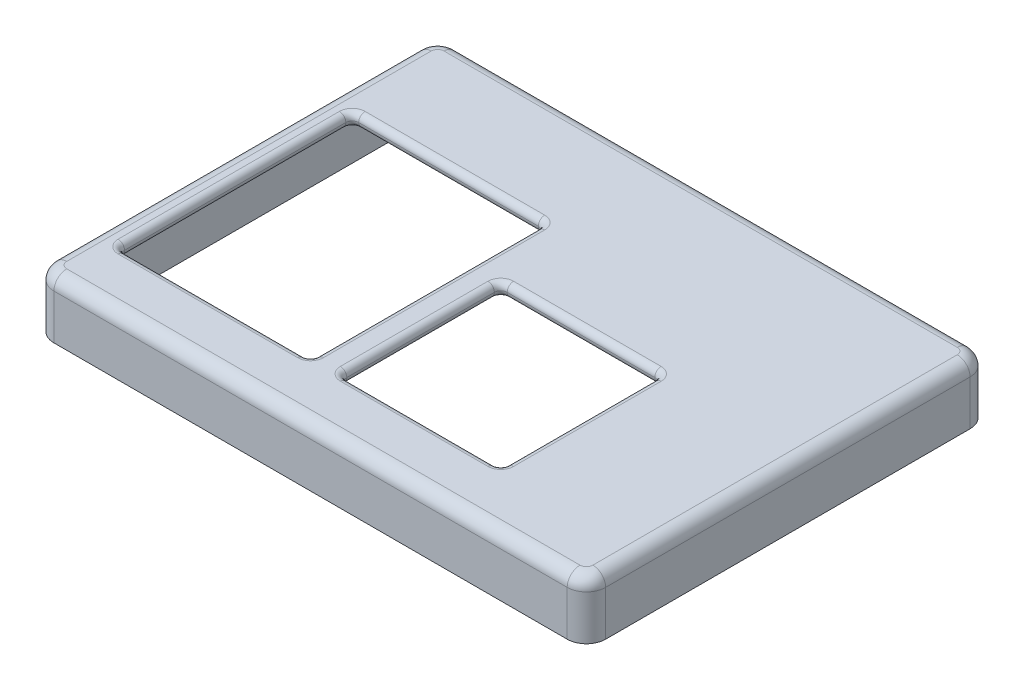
SolidWorks part; units mm, degrees
ref_plane "Front Plane" through (0, 0, 0) normal (0, 0, 1) x (1, 0, 0)
ref_plane "Top Plane" through (0, 0, 0) normal (0, 1, 0) x (1, 0, 0)
ref_plane "Right Plane" through (0, 0, 0) normal (1, 0, 0) x (0, 0, -1)
sketch "Sketch4" plane through (0, 0, 0) normal (0, 1, 0) x (1, 0, 0)
  line L1 (-43, -31.4) -> (43, -31.4)
  line L2 (-43, -31.4) -> (-43, 31.4)
  line L3 (-43, 31.4) -> (43, 31.4)
  line L4 (43, -31.4) -> (43, 31.4)
  line L5 (-41, 29.4) -> (41, 29.4)
  line L6 (-41, 29.4) -> (-41, -29.4)
  line L7 (-41, -29.4) -> (41, -29.4)
  line L8 (41, 29.4) -> (41, -29.4)
  point P0 (0, 0)
  point P6 (0, 0)
  point P11 (0, 0)
  dimension "D1" = 86
  dimension "D2" = 62.8
  dimension "D3" = 82
  dimension "D4" = 58.8
extrude "Boss-Extrude1" add sketch "Sketch4" along normal blind 7
sketch "Sketch5" plane through (0, 7, 0) normal (0, 1, 0) x (1, 0, 0)
  line L1 (-43, -31.4) -> (43, -31.4)
  line L2 (-43, -31.4) -> (-43, 31.4)
  line L3 (-43, 31.4) -> (43, 31.4)
  line L4 (43, -31.4) -> (43, 31.4)
  line L5 (-43, -31.4) -> (43, 31.4) construction
  line L6 (-43, 31.4) -> (43, -31.4) construction
  point P0 (0, 0)
extrude "Boss-Extrude2" add sketch "Sketch5" along normal blind 2
sketch "Sketch6" plane through (0, 0, 0) normal (0, -1, 0) x (1, 0, 0)
  line L15 (-9, 22.4) -> (-9, -14.1)
  line L16 (-9, -14.1) -> (-39, -14.1)
  line L17 (-39, 22.4) -> (-39, -14.1)
  line L18 (-9, 22.4) -> (-39, 22.4)
  line L19 (-4.5, 22.25) -> (20.5, 22.25)
  line L20 (-4.5, 22.25) -> (-4.5, -2.75)
  line L21 (-4.5, -2.75) -> (20.5, -2.75)
  line L22 (20.5, 22.25) -> (20.5, -2.75)
  dimension "D1" = 30
  dimension "D2" = 36.5
  dimension "D3" = 0.15
  dimension "D4" = 25
  dimension "D5" = 25
  dimension "D6" = 4.5
extrude "Cut-Extrude1" cut sketch "Sketch6" against normal through all
fillet "Fillet1" radius 3 4 edges at (43, 4.5, 31.4) (43, 4.5, -31.4) (-43, 4.5, -31.4) (-43, 4.5, 31.4)
fillet "Fillet2" radius 2 8 edges at (42.1213, 9, 30.5213) (-42.1213, 9, 30.5213) (-42.1213, 9, -30.5213) (42.1213, 9, -30.5213) (0, 9, 31.4) (-43, 9, 0) (0, 9, -31.4) (43, 9, 0)
fillet "Fillet8" radius 1 8 edges at (-39, 9, 4.15) (-39, 7, 4.15) (-24, 9, -14.1) (-24, 7, -14.1) (-24, 9, 22.4) (-24, 7, 22.4) (-9, 9, 4.15) (-9, 7, 4.15)
fillet "Fillet9" radius 1 8 edges at (8, 9, -2.75) (8, 7, -2.75) (-4.5, 9, 9.75) (-4.5, 7, 9.75) (20.5, 9, 9.75) (20.5, 7, 9.75) (8, 9, 22.25) (8, 7, 22.25)
